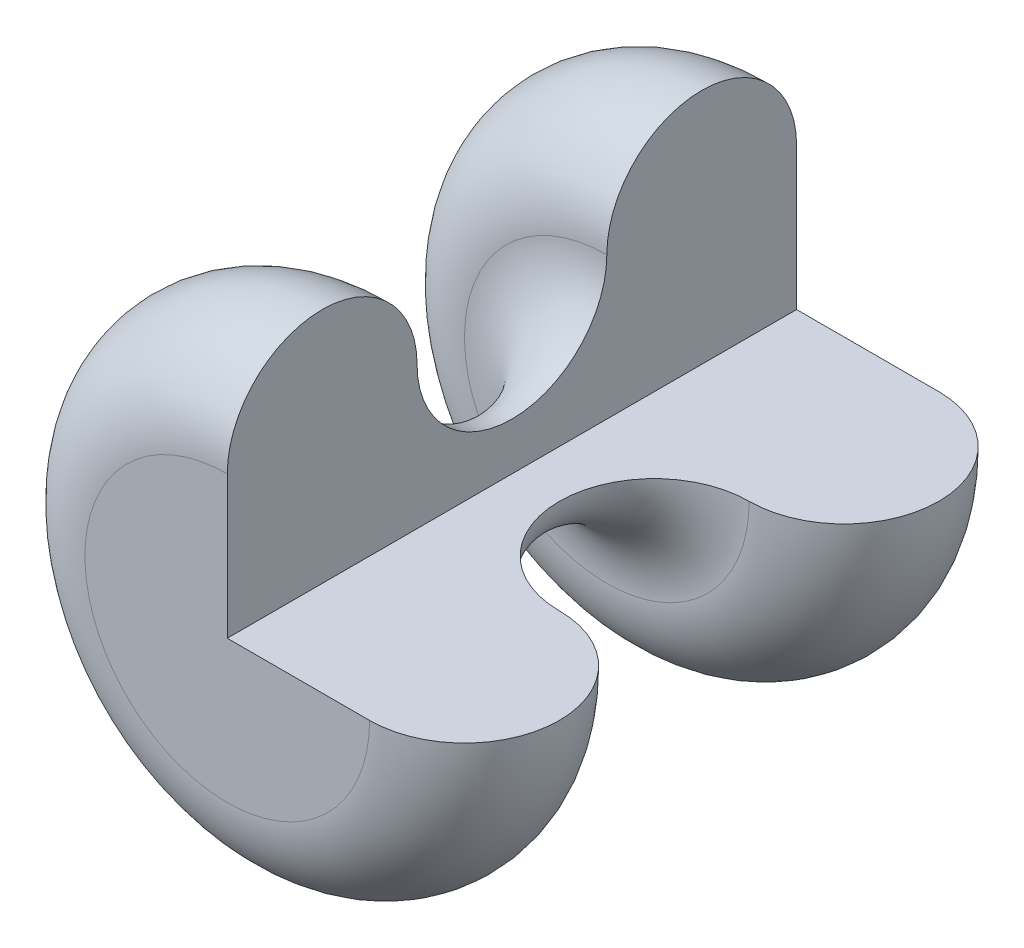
SolidWorks part; units mm, degrees
ref_plane "Plane1" through (0, 0, 0) normal (0, 0, 1) x (1, 0, 0)
ref_plane "Plane2" through (0, 0, 0) normal (0, 1, 0) x (1, 0, 0)
ref_plane "Plane3" through (0, 0, 0) normal (1, 0, 0) x (0, 0, -1)
sketch "Sketch1" plane through (0, 0, 0) normal (0, 1, 0) x (1, 0, 0)
  line L0 (0, -24.3623) -> (30.2428, -24.3623)
  line L1 (0, 104.1696) -> (0, -41.5839) construction
  line L2 (0, 96.6089) -> (0, -24.3623)
  line L3 (30.2428, 96.6089) -> (0, 96.6089)
  arc A0 (30.2428, -24.3623) -> (30.2428, 15.9615) centre (30.2428, -4.2004) ccw
  arc A1 (30.2428, 15.9615) -> (30.2428, 56.2852) centre (30.2428, 36.1233) cw
  arc A2 (30.2428, 56.2852) -> (30.2428, 96.6089) centre (30.2428, 76.4471) ccw
revolve "Base-Revolve" add sketch "Sketch1" angle 270 about L1
